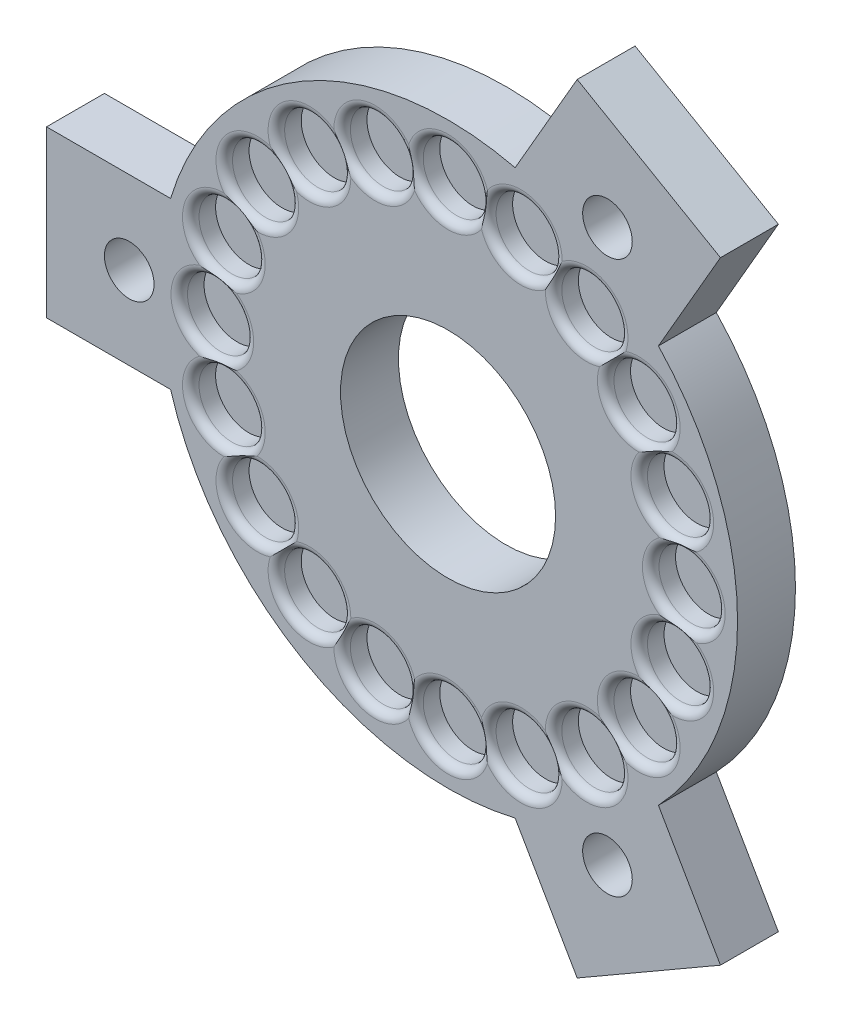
SolidWorks part; units mm, degrees
ref_plane "Ebene vorne" through (0, 0, 0) normal (0, 0, 1) x (1, 0, 0)
ref_plane "Ebene oben" through (0, 0, 0) normal (0, 1, 0) x (1, 0, 0)
ref_plane "Ebene rechts" through (0, 0, 0) normal (1, 0, 0) x (0, 0, -1)
sketch "Skizze1" plane through (0, 0, 0) normal (0, 0, 1) x (1, 0, 0)
  circle A0 centre (0, 0) radius 30.1538
  circle A1 centre (0, 30.1538) radius 4.3077
  circle A2 centre (9.3181, 28.678) radius 4.3077
  circle A3 centre (17.724, 24.395) radius 4.3077
  circle A4 centre (24.395, 17.724) radius 4.3077
  circle A5 centre (28.678, 9.3181) radius 4.3077
  circle A6 centre (30.1538, 0) radius 4.3077
  circle A7 centre (28.678, -9.3181) radius 4.3077
  circle A8 centre (24.395, -17.724) radius 4.3077
  circle A9 centre (17.724, -24.395) radius 4.3077
  circle A10 centre (9.3181, -28.678) radius 4.3077
  circle A11 centre (0, -30.1538) radius 4.3077
  circle A12 centre (-9.3181, -28.678) radius 4.3077
  circle A13 centre (-17.724, -24.395) radius 4.3077
  circle A14 centre (-24.395, -17.724) radius 4.3077
  circle A15 centre (-28.678, -9.3181) radius 4.3077
  circle A16 centre (-30.1538, 0) radius 4.3077
  circle A17 centre (-28.678, 9.3181) radius 4.3077
  circle A18 centre (-24.395, 17.724) radius 4.3077
  circle A19 centre (-17.724, 24.395) radius 4.3077
  circle A20 centre (-9.3181, 28.678) radius 4.3077
  circle A21 centre (0, 0) radius 35
  point P46 (0, 0)
  dimension "D1" = 20
  dimension "D2" = 70
extrude "Aufsatz-Linear austragen3" add sketch "Skizze1" along normal blind 7 contours A21
sketch "Skizze3" plane through (0, 0, 7) normal (0, 0, 1) x (1, 0, 0)
  circle A0 centre (0, 0) radius 28.5
  circle A1 centre (0, 28.5) radius 4
  circle A2 centre (8.807, 27.1051) radius 4
  circle A3 centre (16.7519, 23.057) radius 4
  circle A4 centre (23.057, 16.7519) radius 4
  circle A5 centre (27.1051, 8.807) radius 4
  circle A6 centre (28.5, 0) radius 4
  circle A7 centre (27.1051, -8.807) radius 4
  circle A8 centre (23.057, -16.7519) radius 4
  circle A9 centre (16.7519, -23.057) radius 4
  circle A10 centre (8.807, -27.1051) radius 4
  circle A11 centre (0, -28.5) radius 4
  circle A12 centre (-8.807, -27.1051) radius 4
  circle A13 centre (-16.7519, -23.057) radius 4
  circle A14 centre (-23.057, -16.7519) radius 4
  circle A15 centre (-27.1051, -8.807) radius 4
  circle A16 centre (-28.5, 0) radius 4
  circle A17 centre (-27.1051, 8.807) radius 4
  circle A18 centre (-23.057, 16.7519) radius 4
  circle A19 centre (-16.7519, 23.057) radius 4
  circle A20 centre (-8.807, 27.1051) radius 4
  point P46 (0, 0)
  dimension "D1" = 20
  dimension "D2" = 57
  dimension "D3" = 8
extrude "Schnitt-Linear austragen1" cut sketch "Skizze3" against normal blind 3 contours A0 A8 | A0 A8 | A0 A3 | A0 A3 | A10 | A9 | A7 | A6 | A5 | A4 | A2 | A1 | A20 | A19 | A18 | A17 | A16 | A15 | A14 | A13 | A12 | A11
sketch "Skizze4" plane through (0, 0, 7) normal (0, 0, 1) x (1, 0, 0)
  circle A0 centre (0, 0) radius 13
  dimension "D1" = 26
extrude "Schnitt-Linear austragen2" cut sketch "Skizze4" against normal up to next
ref_plane "Ebene1" through (0, 0, 0) normal (0, 0, -1) x (-1, 0, 0)
sketch "Skizze6" plane through (0, 0, 0) normal (0, 0, -1) x (-1, 0, 0)
  line L0 (-15.6103, -47.0378) -> (-32.9308, -37.0378)
  line L5 (48.541, 10) -> (33.541, 10)
  line L6 (48.541, 10) -> (48.541, -10)
  line L7 (48.541, -10) -> (33.541, -10)
  line L8 (33.541, 10) -> (33.541, -10)
  line L9 (-15.6103, -47.0378) -> (-8.1103, -34.0474)
  line L10 (-8.1103, -34.0474) -> (-25.4308, -24.0474)
  line L11 (-32.9308, -37.0378) -> (-25.4308, -24.0474)
  line L12 (-32.9308, 37.0378) -> (-15.6103, 47.0378)
  line L13 (-32.9308, 37.0378) -> (-25.4308, 24.0474)
  line L14 (-25.4308, 24.0474) -> (-8.1103, 34.0474)
  line L15 (-15.6103, 47.0378) -> (-8.1103, 34.0474)
  circle A0 centre (0, 0) radius 35 construction
  point P18 (0, 0)
  dimension "D1" = 3
  dimension "D3" = 20
  dimension "D4" = 15
  dimension "D5" = 10
extrude "Aufsatz-Linear austragen4" add sketch "Skizze6" against normal blind 7
sketch "Skizze9" plane through (0, 0, 0) normal (0, 0, -1) x (-1, 0, 0)
  line L0 (48.541, -10) -> (48.541, 10) construction
  circle A0 centre (38.541, 0) radius 3
  circle A1 centre (-19.2705, -33.3775) radius 3
  circle A2 centre (-19.2705, 33.3775) radius 3
  point P11 (0, 0)
  dimension "D1" = 10
  dimension "D2" = 3
extrude "Schnitt-Linear austragen5" cut sketch "Skizze9" against normal up to next
fillet "Verrundung1" radius 1 20 edges at (27.057, 16.7519, 7) (20.7519, 23.057, 7) (12.807, 27.1051, 7) (4, 28.5, 7) (-4.807, 27.1051, 7) (-12.7519, 23.057, 7) (-19.057, 16.7519, 7) (-23.1051, 8.807, 7) (-24.5, 0, 7) (-23.1051, -8.807, 7) (-19.057, -16.7519, 7) (-12.7519, -23.057, 7) (-4.807, -27.1051, 7) (4, -28.5, 7) (12.807, -27.1051, 7) (20.7519, -23.057, 7) (27.057, -16.7519, 7) (31.1051, -8.807, 7) (31.1051, 8.807, 7) (32.5, 0, 7)
